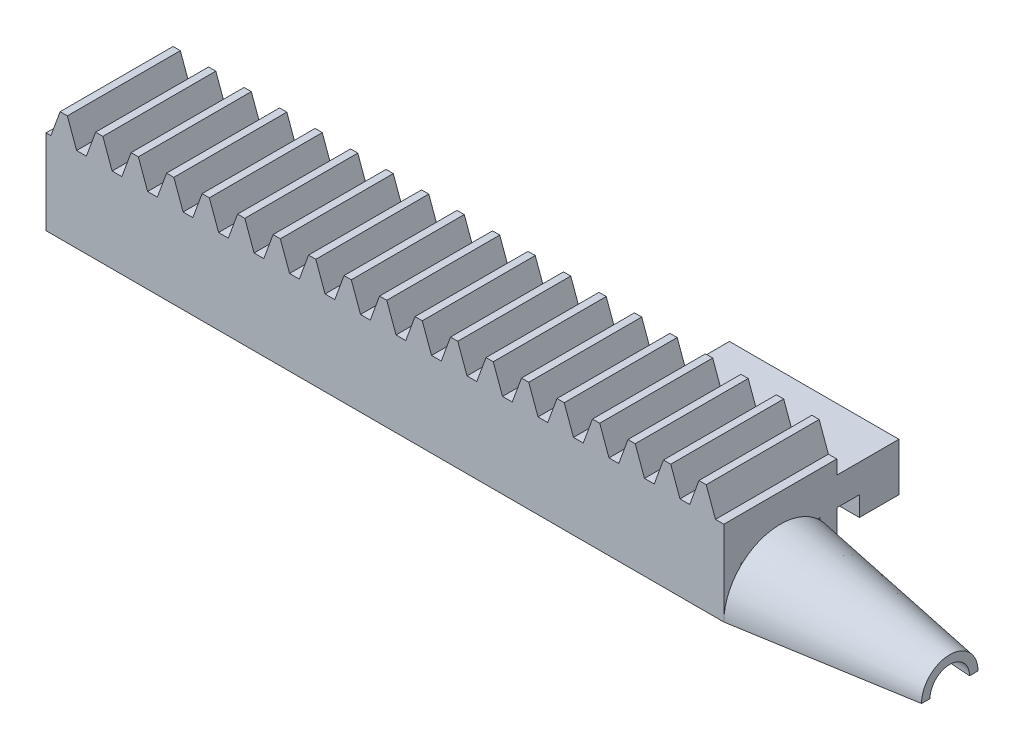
SolidWorks part; units mm, degrees
extrude "Blank" add sketch "BlankSke" against normal blind 20
sketch "BlankSke" plane through (0, 0, 0) normal (0, 0, 1) x (1, 0, 0)
  line L1 (0, 0) -> (120, 0)
  line L2 (0, 0) -> (0, 12)
  line L3 (0, 12) -> (120, 12)
  line L4 (120, 0) -> (120, 12)
ref_plane "Plane1" through (0, 0, 0) normal (0, 0, 1) x (1, 0, 0)
ref_plane "Plane2" through (0, 0, 0) normal (0, 1, 0) x (1, 0, 0)
ref_plane "Plane3" through (0, 0, 0) normal (1, 0, 0) x (0, 0, -1)
other "Configuration Table"
sketch "HoldingSke" plane through (0, 0, 0) normal (0, 1, 0) x (1, 0, 0)
  line L0 (0, 0) -> (0.0696, 0.4951)
  line L1 (-15, 0) -> (100, 0) construction
  line L2 (0, 0) -> (-2.1039, 2.3779)
  line L3 (0, 0) -> (-11.863, 4.5341)
  line L4 (0, 0) -> (8.0624, 3.0949)
  line L5 (0, 0) -> (-23.7986, -8.8762)
  line L6 (0, 0) -> (-10.5278, -7.1032)
  line L9 (-71.009, 38.7566) -> (41.7541, 79.799)
  line L10 (-76.2, 4.3779) -> (-66.2, 4.3779)
  line L11 (0, 0) -> (-10, 0)
  line L12 (-76.2, 101.6) -> (-76.133, 101.6)
  line L13 (24.9733, 27.94) -> (52.9518, 28.4284)
  line L14 (24.9733, 27.94) -> (24.9743, 27.94)
  line L15 (24.9733, 27.94) -> (100.4006, 29.5858)
  circle A0 centre (0, 0) radius 19.05
  circle A1 centre (0, 0) radius 5
  circle A2 centre (0, 0) radius 12.7
sketch "TooCutSkeIll" plane through (0, 0, 0) normal (0, 0, 1) x (1, 0, 0)
  line L0 (-2.4806, 11.9474) -> (-0.9819, 7.8296)
  line L1 (-0.5111, 7.5) -> (0.5111, 7.5)
  line L2 (0.9819, 7.8296) -> (2.4806, 11.9474)
  line L3 (120, 12) -> (0, 12) construction
  line L4 (0, 0) -> (0, 64.897) construction
  line L5 (-13.208, 10) -> (12.954, 10) construction
  line L6 (0, 0) -> (120, 0) construction
  line L7 (1.7718, 10) -> (1.7718, 48.7463) construction
  line L8 (-1.7718, 10) -> (-1.7718, 48.7463) construction
  line L9 (2.5558, 12) -> (2.5558, 12.0254)
  line L10 (-2.5558, 12) -> (-2.5558, 12.0254)
  line L11 (-2.5558, 12.0254) -> (2.5558, 12.0254)
  arc A0 (0.5111, 7.5) -> (0.9819, 7.8296) centre (0.5111, 8.001) ccw
  arc A1 (-0.9819, 7.8296) -> (-0.5111, 7.5) centre (-0.5111, 8.001) ccw
  arc A2 (2.5558, 12) -> (2.4806, 11.9474) centre (2.5558, 11.92) ccw
  arc A3 (-2.4806, 11.9474) -> (-2.5558, 12) centre (-2.5558, 11.92) ccw
extrude "ToothCutIll" [suppressed] cut sketch "TooCutSkeIll" against normal through all
sketch "TooCutSkeSim" plane through (0, 0, 0) normal (0, 0, 1) x (1, 0, 0)
  line L0 (0.8619, 7.5) -> (-0.8619, 7.5)
  line L1 (2.509, 12.0254) -> (0.8619, 7.5)
  line L2 (0, 17.4625) -> (0, 53.467) construction
  line L3 (2.509, 12.0254) -> (-2.509, 12.0254)
  line L6 (-2.509, 12.0254) -> (-0.8619, 7.5)
  line L9 (-1.7718, 10) -> (1.7718, 10) construction
  line L10 (0, 0) -> (120, 0) construction
  line L11 (1.7718, 10) -> (1.7718, 53.467) construction
  line L12 (-1.7718, 10) -> (-1.7718, 53.467) construction
extrude "ToothCutSim" cut sketch "TooCutSkeSim" against normal through all
pattern_linear "TeethCuts" count 20 spacing 6.2832 along (1, 0, 0) of "ToothCutIll", "ToothCutSim"
sketch "草图1" plane through (0, 0, 0) normal (0, -1, 0) x (1, 0, 0)
  line L0 (120, -20) -> (0, -20)
  line L1 (0, -20) -> (0, -17)
  line L2 (0, -20) -> (0, 0) construction
  line L3 (0, -17) -> (120, -17)
  line L4 (120, -20) -> (120, 0) construction
  line L5 (120, -17) -> (120, -20)
  line L6 (120, -10) -> (0, -10) construction
  line L7 (0, -3) -> (120, -3)
  line L8 (0, 0) -> (0, -3)
  line L9 (120, 0) -> (0, 0)
  line L10 (120, -3) -> (120, 0)
  dimension "D1" = 3
extrude "凸台-拉伸1" add sketch "草图1" along normal blind 7.5
sketch "草图3" plane through (0, 0, 0) normal (-1, 0, 0) x (0, 0, 1)
  line L0 (0, -7.5) -> (-29.3324, -7.5) construction
  line L1 (-10, 12) -> (-10, -30.8459) construction
  line L2 (0, 12) -> (-20, 12) construction
  line L3 (-20, -7.5) -> (0, -7.5) construction
  line L5 (-20, -7.5) -> (0, -7.5)
  arc A0 (-20, -7.5) -> (0, -7.5) centre (-10, -7.5) ccw
ref_plane "基准面1" through (0, 0, -10) normal (0, 0, 1) x (1, 0, 0)
sketch "草图4" plane through (120, 0, 0) normal (1, 0, 0) x (0, 0, -1)
  line L0 (20, 0.02) -> (20, 5.02)
  line L1 (20, -7.5) -> (20, 7.5) construction
  line L2 (20, 5.02) -> (31, 5.02)
  line L3 (31, 5.02) -> (31, -3.48)
  line L4 (31, -3.48) -> (24, -3.48)
  line L5 (24, -3.48) -> (24, 0.02)
  line L6 (24, 0.02) -> (20, 0.02)
  line L7 (20, -7.5) -> (17, -7.5) construction
  dimension "D1" = 7.52
  dimension "D2" = 5
  dimension "D3" = 11
  dimension "D4" = 3.5
  dimension "D5" = 4
extrude "凸台-拉伸2" add sketch "草图4" against normal up to vertex (30 mm away)
sketch "草图5" plane through (120, 0, 0) normal (1, 0, 0) x (0, 0, -1)
  line L1 (10, -7.5) -> (0, -7.5) construction
  line L2 (3, -7.5) -> (0, -7.5) construction
  line L3 (10, -7.5) -> (10, 0) construction
  line L4 (17, 0) -> (3, 0) construction
  circle A0 centre (10, -7.5) radius 10
  dimension "D1" = 20
ref_plane "基准面2" through (150, 0, 0) normal (1, 0, 0) x (0, 0, -1)
sketch "草图6" plane through (150, 0, 0) normal (1, 0, 0) x (0, 0, -1)
  line L1 (10, -7.5) -> (10, 0) construction
  line L2 (17, 0) -> (3, 0) construction
  line L3 (10, -7.5) -> (3, -7.5) construction
  circle A0 centre (10, -7.5) radius 5
  dimension "D1" = 10
loft "放样2" add profiles "草图5", "草图6"
sketch "草图7" plane through (150, 0, 0) normal (1, 0, 0) x (0, 0, -1)
  line L1 (29.2089, -7.5) -> (22.6991, -25.7001)
  line L2 (22.6991, -25.7001) -> (-6.2497, -20.1624)
  line L3 (-6.2497, -20.1624) -> (-7.2979, -7.5)
  line L4 (-7.2979, -7.5) -> (29.2089, -7.5)
  point P0 (29.1386, -7.6966)
extrude "切除-拉伸3" cut sketch "草图7" against normal blind 42
sketch "草图10" plane through (150, 0, 0) normal (1, 0, 0) x (0, 0, -1)
  line L0 (15, -7.5) -> (5, -7.5) construction
  circle A0 centre (10, -7.5) radius 3.5
  dimension "D1" = 7
extrude "切除-拉伸4" cut sketch "草图10" against normal blind 42 draft 4
equation "' \"Module@HoldingSke\" = 6.35"
equation "' \"Num_teeth@HoldingSke\" = 12"
equation "' \"Ap@HoldingSke\" =  20"
equation "' \"Ap@HoldingSke\" = 20"
equation "' \"Width@HoldingSke\" = 0.25 * 25.4"
equation "' \"Show_teeth@HoldingSke\" = 500"
equation "' \"Backlash@HoldingSke\" = 0.009 * 25.4"
equation "' \"Addendum_fac@HoldingSke\" = 1.0"
equation "' \"Dedendum_fac@HoldingSke\" = 1.25"
equation "' \"Dedendum_add@HoldingSke\" = 0.00005 * 25.4"
equation "' \"Clearance_fac@HoldingSke\" = 0.25"
equation "' \"Pitch_height@HoldingSke\" = 1 * 25.4"
equation "' \"Length@HoldingSke\" = 4.71 * 25.4"
equation "\"Pitch@HoldingSke\" = 1 / \"Module@HoldingSke\""
equation "\"MPH@HoldingSke\" = \"Dedendum_fac@HoldingSke\" / \"Pitch@HoldingSke\" + 2 * \"Dedendum_add@HoldingSke\" + 0.002 * 25.4"
equation "\"MPH@HoldingSke\" = ((sgn( \"MPH@HoldingSke\" - \"Pitch_height@HoldingSke\")+1)*( \"MPH@HoldingSke\" - \"Pitch_height@HoldingSke\"))/2 + \"Pitch_height@HoldingSke\""
equation "\"Blank_height@BlankSke\" = \"Pitch_height@HoldingSke\" + \"Addendum_fac@HoldingSke\"  / \"Pitch@HoldingSke\" "
equation "\"Length@BlankSke\" =  \"Length@HoldingSke\""
equation "\"Pressure_angle@TooCutSkeIll\" = \"Ap@HoldingSke\""
equation "\"Addendum_plus@TooCutSkeIll\" =  \"Addendum_fac@HoldingSke\"  / \"Pitch@HoldingSke\" + 0.001 *25.4"
equation "\"Dedendum@TooCutSkeIll\" = \"Dedendum_fac@HoldingSke\"  / \"Pitch@HoldingSke\""
equation "\"Pitch_height@TooCutSkeIll\" =  \"MPH@HoldingSke\""
equation "\"Gap_width@TooCutSkeIll\" = 3.14159265 / 2 / \"Pitch@HoldingSke\" + 6 * \"Backlash@HoldingSke\""
equation "\"Pressure_angle@TooCutSkeSim\" = \"Ap@HoldingSke\""
equation "\"Addendum_plus@TooCutSkeSim\" =  \"Addendum_fac@HoldingSke\"  / \"Pitch@HoldingSke\" + 0.001 * 25.4"
equation "\"Dedendum@TooCutSkeSim\" = \"Dedendum_fac@HoldingSke\"  / \"Pitch@HoldingSke\""
equation "\"Pitch_height@TooCutSkeSim\" =  \"MPH@HoldingSke\""
equation "\"Gap_width@TooCutSkeSim\" = 3.14159265 / 2 / \"Pitch@HoldingSke\" + 6 * \"Backlash@HoldingSke\""
equation "\"Root_fillet@TooCutSkeIll\" = \"Clearance_fac@HoldingSke\" / \"Pitch@HoldingSke\" + \"Dedendum_add@HoldingSke\""
equation "\"Break_rad@TooCutSkeIll\" = 0.02 / \"Pitch@HoldingSke\" * 2"
equation "\"Linear_pitch@TeethCuts\" = 3.14159265 / \"Pitch@HoldingSke\""
equation "\"Num_teeth@HoldingSke\" = int( ( \"Length@HoldingSke\" + 0 ) / (3.14159265 / \"Pitch@HoldingSke\")) + 0.9999  + 1"
equation " \"Num_teeth@TeethCuts\" = int( \"Show_teeth@HoldingSke\" ) + 1"
equation " \"Num_teeth@TeethCuts\" = ((sgn( \"Num_teeth@TeethCuts\" - \"Num_teeth@HoldingSke\" )-1)*( \"Num_teeth@TeethCuts\" - \"Num_teeth@HoldingSke\" ))/-2+ \"Num_teeth@HoldingSke\""
equation " \"Num_teeth@TeethCuts\" = ((sgn( \"Num_teeth@TeethCuts\" - 2.0)+1)*( \"Num_teeth@TeethCuts\" - 2.0))/2 +2.0"
